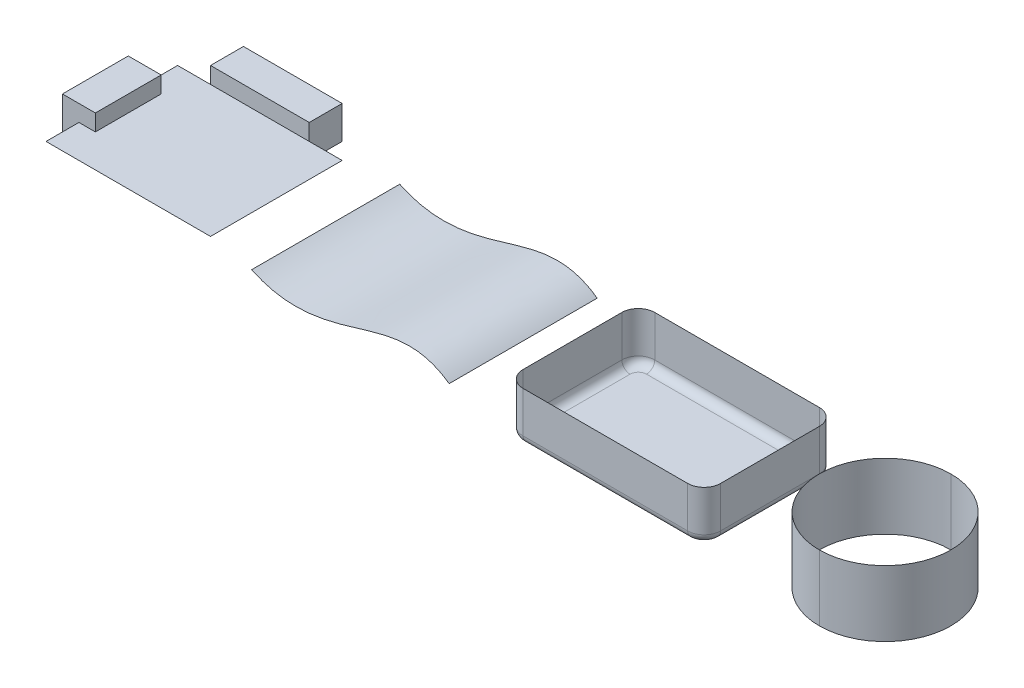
SolidWorks part; units mm, degrees
ref_plane "Front Plane" through (0, 0, 0) normal (0, 0, 1) x (1, 0, 0)
ref_plane "Top Plane" through (0, 0, 0) normal (0, 1, 0) x (1, 0, 0)
ref_plane "Right Plane" through (0, 0, 0) normal (1, 0, 0) x (0, 0, -1)
sketch "Sketch1" plane through (0, 0, 0) normal (0, 1, 0) x (1, 0, 0)
  line L0 (0, 0) -> (80, 0) construction
  line L1 (130, -40) -> (30, -40)
  line L2 (130, -40) -> (130, 40)
  line L3 (130, 40) -> (30, 40)
  line L4 (30, -40) -> (30, 40)
  line L5 (130, -40) -> (30, 40) construction
  line L6 (130, 40) -> (30, -40) construction
  point P0 (80, 0)
  dimension "D1" = 80
  dimension "D2" = 100
  dimension "D3" = 80
surface "Surface-Plane1" sketch "Sketch1"
sketch "Sketch2" plane through (0, 0, 0) normal (0, 0, 1) x (1, 0, 0)
  line L0 (30, 0) -> (130, 0) construction
  line L2 (160, 0) -> (220, 0) construction
  line L3 (220, 0) -> (280, 0) construction
  spline S0 degree 3 poles (160, 0) (180.3182, -9.6954) (220.2175, -1.9898) (260.5532, 14.0612) (280, 0) knots 0 0 0 0 0.495929 1 1 1 1
  point P2 (248.6096, 13.0139)
  point P4 (244.3834, 12.0386)
  point P8 (203.7149, 8.5736)
  point P9 (0, 0)
  point P10 (90, 0)
  point P13 (134.6317, 0)
  point P14 (295.431, 0)
  point P15 (187.4224, -7.7426)
  point P16 (242.0335, 5)
  point P17 (220.0677, -7.3628)
  point P18 (261.7855, 4.6279)
  point P19 (212.3236, -6.1138)
  point P20 (234.0569, -7.3628)
  point P21 (295.5095, 8.1252)
  point P22 (217.3198, -9.3613)
  point P23 (282.2697, 8.375)
  point P24 (194.324, -5.5294)
  point P26 (254.6842, 7.7853)
  dimension "D1" = 160
  dimension "D2" = 60
surface "Surface-Extrude1" sketch "Sketch2" parameters "D1"=90
sketch "Sketch3" plane through (0, 0, 0) normal (0, 1, 0) x (1, 0, 0)
  line L1 (420, -40) -> (320, -40)
  line L2 (430, -30) -> (430, 30)
  line L3 (420, 40) -> (320, 40)
  line L4 (310, -30) -> (310, 30)
  line L5 (430, -40) -> (310, 40) construction
  line L6 (430, 40) -> (310, -40) construction
  arc A0 (430, 30) -> (420, 40) centre (420, 30) ccw
  arc A1 (420, -40) -> (430, -30) centre (420, -30) ccw
  arc A2 (320, -40) -> (310, -30) centre (320, -30) cw
  arc A3 (320, 40) -> (310, 30) centre (320, 30) ccw
  point P0 (370, 0)
  point P17 (392.2701, 0)
  dimension "D1" = 10
  dimension "D2" = 370
  dimension "D3" = 120
  dimension "D4" = 80
surface "Surface-Extrude2" sketch "Sketch3" parameters "D1"=30
surface "Surface-Plane3"
surface "Surface-Knit1"
fillet "Fillet1" radius 5 8 edges at (427.0711, -15, -37.0711) (430, -15, 0) (427.0711, -15, 37.0711) (370, -15, 40) (312.9289, -15, 37.0711) (310, -15, 0) (312.9289, -15, -37.0711) (370, -15, -40)
sketch "Sketch5" plane through (0, 0, 0) normal (0, 1, 0) x (1, 0, 0)
  line L0 (500, 40) -> (500, -40) construction
  arc A0 (500, 40) -> (500, -40) centre (500, 0) ccw
  point P3 (455.1019, 0)
  point P4 (522.7699, 0)
  dimension "D1" = 40
  dimension "D2" = 500
surface "Surface-Extrude3" sketch "Sketch5" parameters "D1"=40
sketch "Sketch6" plane through (0, 0, 0) normal (0, 1, 0) x (1, 0, 0)
  arc A0 (500, 40) -> (500, -40) centre (500, 0) cw
  dimension "D1" = 40
surface "Surface-Extrude4" sketch "Sketch6" parameters "D1"=40
sketch "Sketch9" plane through (0, 0, 0) normal (1, 0, 0) x (0, 0, -1)
  line L0 (0, 0) -> (50, 50) construction
  line L1 (0, 0) -> (5, 0) construction
  point P3 (90.0166, -50)
  point P5 (57.3633, 40.789)
  dimension "D1" = 45
  dimension "D2" = 50
  dimension "D3" = 5
sketch "Sketch10" plane through (0, 0, 0) normal (0, 0, 1) x (1, 0, 0)
  line L2 (0, 0) -> (-5, 0) construction
  line L3 (30, 0) -> (130, 0) construction
  line L4 (0, 0) -> (-50, 50) construction
  point P1 (50, 63.1004)
  point P3 (-69.0507, 50)
  point P4 (-23.5673, 0)
  dimension "D1" = 45
  dimension "D2" = 5
  dimension "D3" = 50
sketch "Sketch11" plane through (0, 0, 0) normal (0, 1, 0) x (1, 0, 0)
  line L0 (30, 40) -> (30, -40) construction
  line L1 (20, -20) -> (40, -20)
  line L2 (20, -20) -> (20, 20)
  line L3 (20, 20) -> (40, 20)
  line L4 (40, -20) -> (40, 20)
  line L5 (20, -20) -> (40, 20) construction
  line L6 (20, 20) -> (40, -20) construction
  line L14 (130, 40) -> (30, 40) construction
  line L15 (50, 40) -> (110, 40)
  line L16 (50, 40) -> (50, 60)
  line L17 (50, 60) -> (110, 60)
  line L18 (110, 40) -> (110, 60)
  point P0 (30, 0)
  point P7 (131.9456, 40)
  point P8 (0, 0)
  point P14 (80, 40)
  dimension "D1" = 20
  dimension "D2" = 40
  dimension "D5" = 20
  dimension "D6" = 60
extrude "Boss-Extrude1" add sketch "Sketch11" along normal mid plane 20 separate body
